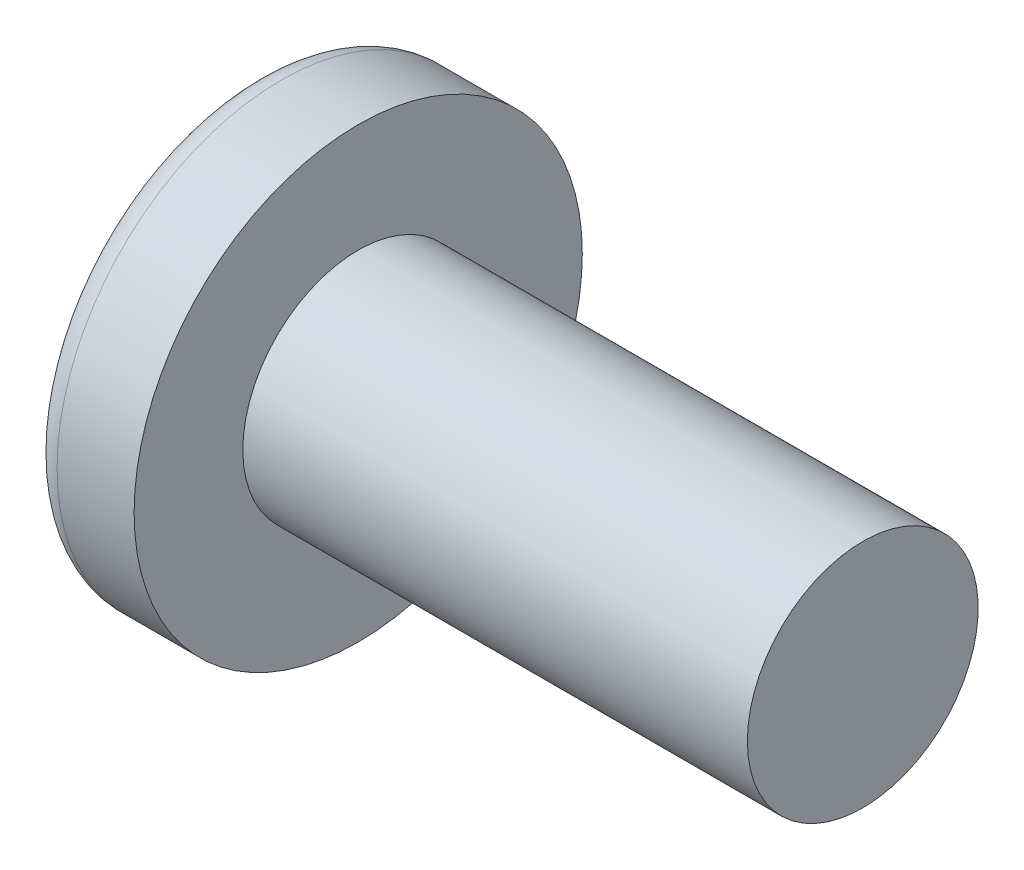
SolidWorks part; units mm, degrees
ref_plane "Plane1" through (0, 0, 0) normal (0, 0, 1) x (1, 0, 0)
ref_plane "Plane2" through (0, 0, 0) normal (0, 1, 0) x (1, 0, 0)
ref_plane "Plane3" through (0, 0, 0) normal (1, 0, 0) x (0, 0, -1)
sketch "BodySke" plane through (0, 0, 0) normal (0, 0, 1) x (1, 0, 0)
  line L0 (1.5748, 1.0922) -> (1.5748, 2.1209)
  line L1 (1.8021, 6.35) -> (1.8021, -3.175) construction
  line L2 (-25.4, 0) -> (127, 0) construction
  line L3 (6.35, 0) -> (0, 0)
  line L4 (1.5748, 1.0922) -> (6.35, 1.0922)
  line L5 (6.35, 1.0922) -> (6.35, 0)
  line L6 (0.8457, 2.1209) -> (1.5748, 2.1209)
  line L7 (1.5748, -1.0922) -> (6.35, -1.0922) construction
  line L8 (1.5748, 6.35) -> (1.5748, -3.175) construction
  arc A0 (0.6381, 2.0132) -> (0, 0) centre (3.495, 0) ccw
  arc A2 (0.6381, 2.0132) -> (0.8457, 2.1209) centre (0.8457, 1.8669) cw
revolve "Base-Revolve" add sketch "BodySke" angle 360 about L2
sketch "Sketch3" plane through (0, 0, 0) normal (1, 0, 0) x (0, 0, -1)
  line L0 (0.3429, -1.3843) -> (-0.3429, -1.3843)
  line L1 (0.3429, -1.3843) -> (0.3429, 1.3843)
  line L2 (-0.3429, 1.3843) -> (0.3429, 1.3843)
  line L3 (-0.3429, 1.3843) -> (-0.3429, -1.3843)
ref_plane "Plane4" through (1.4986, 0, 0) normal (1, 0, 0) x (0, 0, -1)
sketch "Sketch4" plane through (1.4986, 0, 0) normal (1, 0, 0) x (0, 0, -1)
  line L0 (0.1714, -0.1714) -> (-0.1714, -0.1715)
  line L1 (0.1714, -0.1714) -> (0.1714, 0.1715)
  line L2 (-0.1714, 0.1714) -> (0.1714, 0.1715)
  line L3 (-0.1714, 0.1714) -> (-0.1714, -0.1715)
loft "Cut-Loft1" cut profiles "Sketch3", "Sketch4"
pattern_circular "CirPattern1" count 2 every 90 about axis through (0, 0, 0) along (1, 0, 0) of "Cut-Loft1"
sketch "ThdSchSke" plane through (0, 0, 0) normal (0, 0, 1) x (1, 0, 0)
  line L0 (2.0295, -0.823) -> (1.8409, -1.0922)
  line L1 (2.0295, -0.823) -> (2.218, -1.0922)
  line L2 (2.218, -1.0922) -> (2.218, -1.3653)
  line L3 (-3.175, 0) -> (5.1513, 0) construction
  line L5 (2.218, -1.3653) -> (1.8409, -1.3653)
  line L6 (1.8409, -1.3653) -> (1.8409, -1.0922)
revolve "ThreadSchematic" [suppressed] cut sketch "ThdSchSke" angle 360 about L3
pattern_linear "ThdSchPat" [suppressed]
equation "\"D1@Sketch3\" = \"Cross_dia@Sketch3\" / 2"
equation "\"D2@Sketch3\" = \"Cross_width@Sketch3\" / 2"
equation "\"D1@Sketch4\" = \"Cross_width@Sketch3\" *.5"
equation "\"D2@Sketch4\" = \"D1@Sketch4\""
equation "\"D3@Sketch4\" = \"D1@Sketch4\" / 2"
equation "\"D4@Sketch4\" = \"D2@Sketch4\" / 2"
equation "\"Thread_length@ThreadCosmetic\" = ((sgn( (\"Length@BodySke\" - \"Advance@BodySke\" ) - \"Thread_nom@BodySke\" )-1)*( (\"Length@BodySke\" - \"Advance@BodySke\" ) - \"Thread_nom@BodySke\" ))/-2+ \"Thread_nom@BodySke\""
equation "\"Thread_minor@ThdSchSke\" = \"Thread_minor@ThreadCosmetic\""
equation "\"Diameter@ThdSchSke\" = \"Diameter@BodySke\""
equation "\"Overcut@ThdSchSke\" = \"Diameter@BodySke\" * 1.25"
equation "\"Start@ThdSchSke\" = \"Head_ht@BodySke\" + \"Length@BodySke\" - \"Thread_length@ThreadCosmetic\"  '---Non-countersunk---"
equation "\"Num_threads@ThdSchPat\" = int( \"Thread_length@ThreadCosmetic\" / \"Advance@BodySke\" + 0.999 )  + 1"
equation "\"Advance@ThdSchPat\" = \"Thread_length@ThreadCosmetic\" /  (\"Num_threads@ThdSchPat\" - 1) 'relax it"
